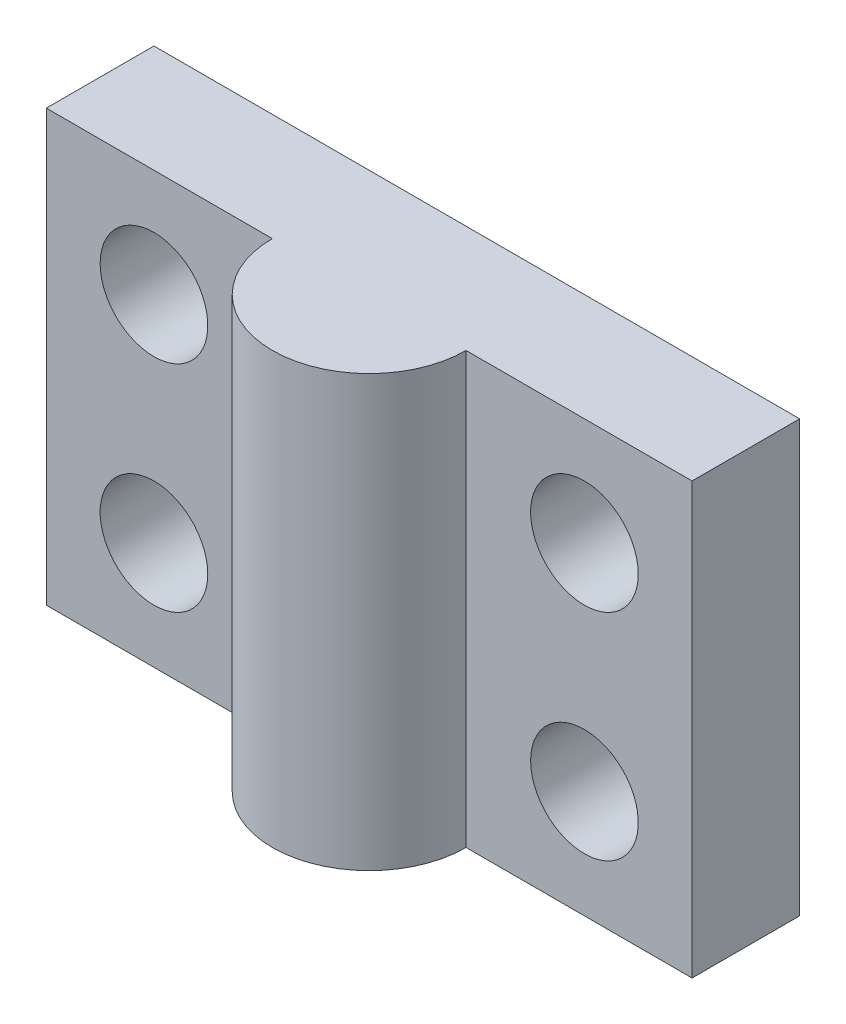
SolidWorks part; units mm, degrees
ref_plane "Alzado" through (0, 0, 0) normal (0, 0, 1) x (1, 0, 0)
ref_plane "Planta" through (0, 0, 0) normal (0, 1, 0) x (1, 0, 0)
ref_plane "Vista lateral" through (0, 0, 0) normal (1, 0, 0) x (0, 0, -1)
sketch "Sketch1" plane through (0, 0, 0) normal (0, 0, 1) x (1, 0, 0)
  line L0 (-10, 0) -> (10, 0) construction
  line L1 (-15, -10) -> (15, -10)
  line L2 (-15, -10) -> (-15, 10)
  line L3 (-15, 10) -> (15, 10)
  line L4 (15, -10) -> (15, 10)
  line L5 (-15, -10) -> (15, 10) construction
  line L6 (-15, 10) -> (15, -10) construction
  line L7 (10, 5) -> (10, -5) construction
  line L8 (0, 0) -> (0, -3.6927) construction
  circle A0 centre (10, 5) radius 2.5
  circle A1 centre (10, -5) radius 2.5
  circle A2 centre (-10, -5) radius 2.5
  circle A3 centre (-10, 5) radius 2.5
  point P0 (0, 0)
  dimension "D3" = 5
  dimension "D1" = 20
  dimension "D2" = 10
  dimension "D4" = 20
  dimension "D5" = 30
extrude "Boss-Extrude1" add sketch "Sketch1" along normal blind 5
sketch "Sketch2" plane through (0, 10, 0) normal (0, 1, 0) x (1, 0, 0)
  line L0 (15, -5) -> (-15, -5) construction
  line L1 (-4.5, -5) -> (4.5, -5)
  arc A0 (-4.5, -5) -> (4.5, -5) centre (0, -5) ccw
  point P3 (0, -5)
  dimension "D1" = 9
extrude "Boss-Extrude2" add sketch "Sketch2" against normal blind 20
